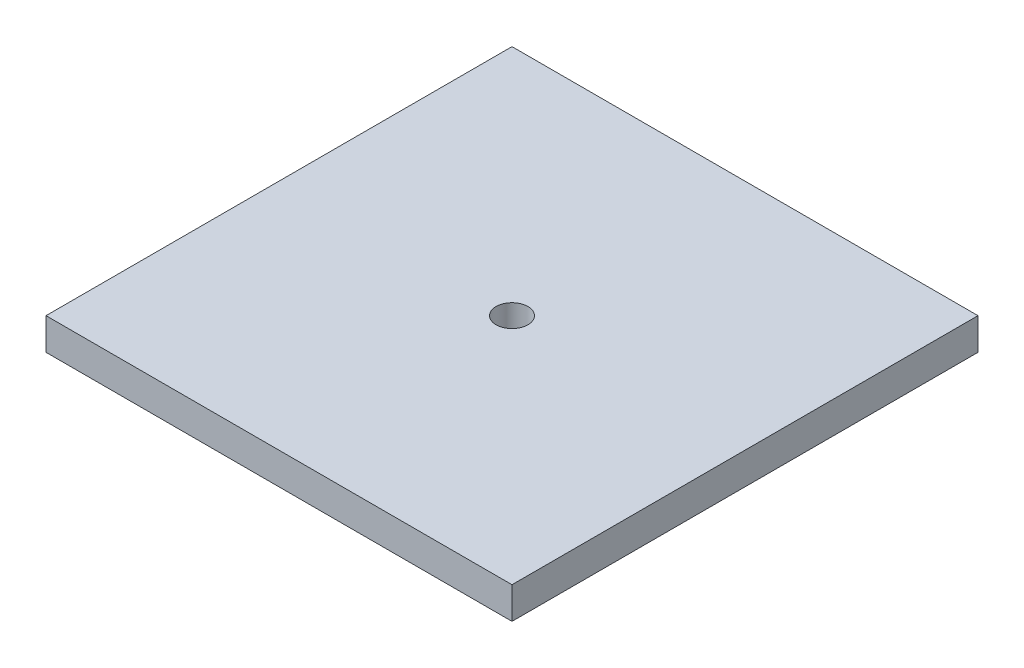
SolidWorks part; units mm, degrees
ref_plane "Plan de face" through (0, 0, 0) normal (0, 0, 1) x (1, 0, 0)
ref_plane "Plan de dessus" through (0, 0, 0) normal (0, 1, 0) x (1, 0, 0)
ref_plane "Plan de droite" through (0, 0, 0) normal (1, 0, 0) x (0, 0, -1)
sketch "Esquisse1" plane through (0, 0, 0) normal (0, 1, 0) x (1, 0, 0)
  line L0 (-14.9101, 44) -> (95.9874, 44) construction
  line L1 (0, 0) -> (88, 0)
  line L2 (0, 0) -> (0, 88)
  line L3 (0, 88) -> (88, 88)
  line L4 (88, 0) -> (88, 88)
  line L5 (44, 91.6049) -> (44, -14.0646) construction
  circle A0 centre (44, 44) radius 3
extrude "Extrusion1" add sketch "Esquisse1" along normal blind 6
